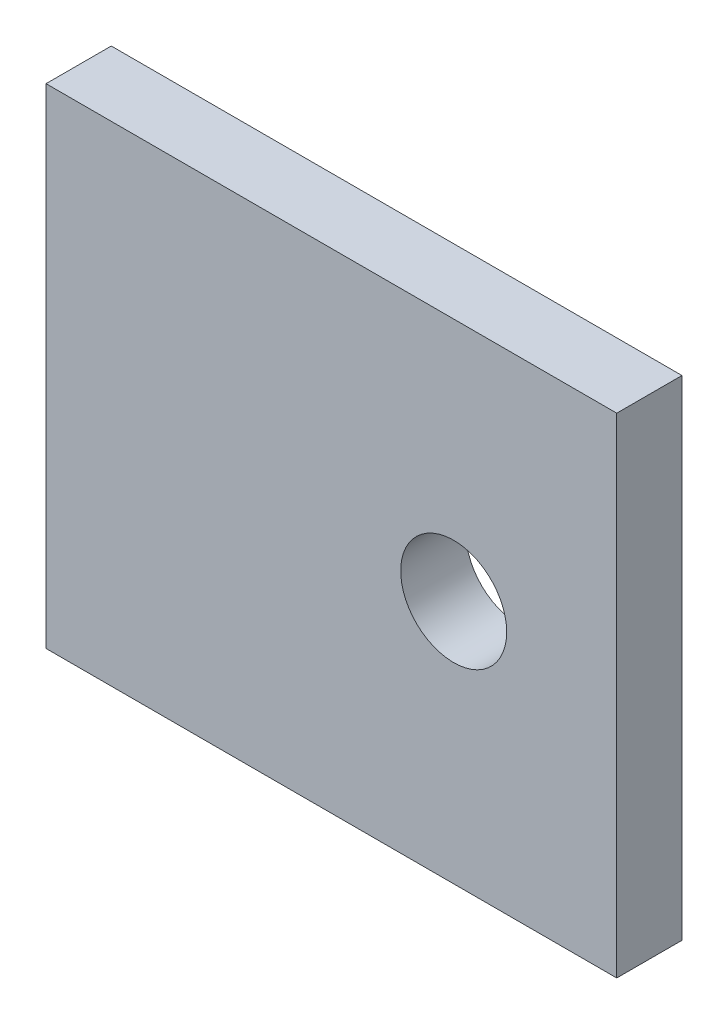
SolidWorks part; units mm, degrees
ref_plane "前视基准面" through (0, 0, 0) normal (0, 0, 1) x (1, 0, 0)
ref_plane "上视基准面" through (0, 0, 0) normal (0, 1, 0) x (1, 0, 0)
ref_plane "右视基准面" through (0, 0, 0) normal (1, 0, 0) x (0, 0, -1)
sketch "草图1" plane through (0, 0, 0) normal (0, 0, 1) x (1, 0, 0)
  line L1 (0, 0) -> (70, 0)
  line L2 (0, 0) -> (0, 60)
  line L3 (0, 60) -> (70, 60)
  line L4 (70, 0) -> (70, 60)
  circle A0 centre (50, 30) radius 6.5
  dimension "D3" = 20
  dimension "D4" = 30
  dimension "D5" = 13
  dimension "D1" = 70
  dimension "D2" = 60
extrude "拉伸1" add sketch "草图1" along normal blind 8
